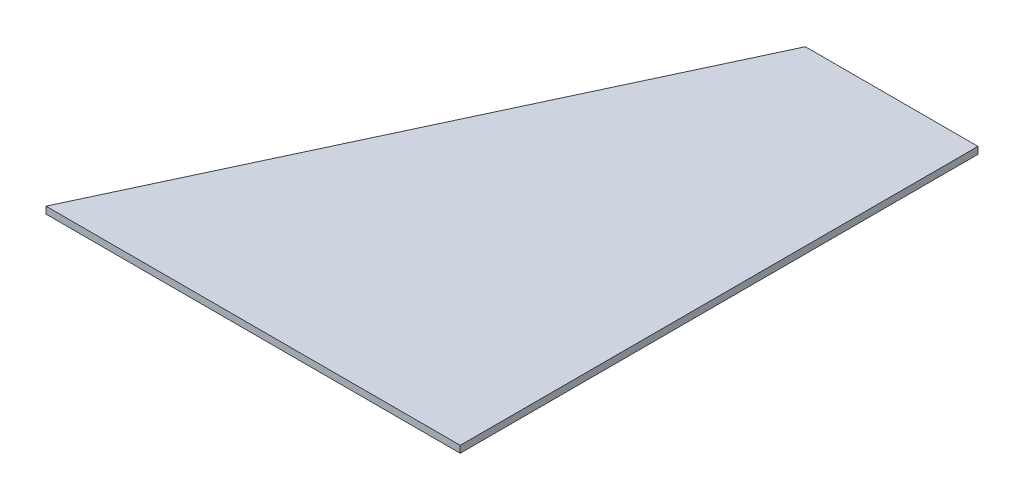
SolidWorks part; units mm, degrees
ref_plane "Front" through (0, 0, 0) normal (0, 0, 1) x (1, 0, 0)
ref_plane "Top" through (0, 0, 0) normal (0, 1, 0) x (1, 0, 0)
ref_plane "Right" through (0, 0, 0) normal (1, 0, 0) x (0, 0, -1)
sketch "Sketch1" plane through (0, 0, 0) normal (0, 1, 0) x (1, 0, 0)
  line L0 (0, 0) -> (60, 0)
  line L1 (60, 0) -> (60, 75)
  line L2 (60, 75) -> (35, 75)
  line L3 (35, 75) -> (0, 0)
extrude "Extrude1" add sketch "Sketch1" along normal blind 1
